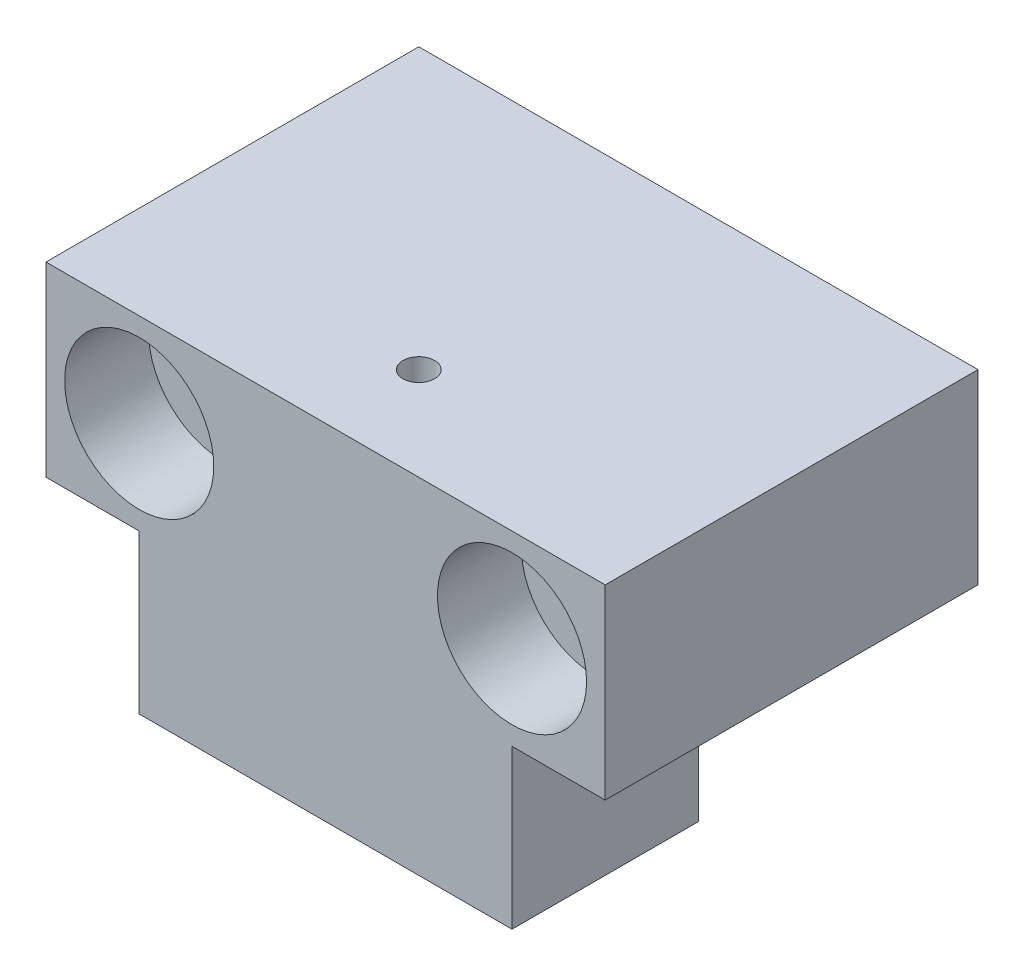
SolidWorks part; units mm, degrees
ref_plane "前视基准面" through (0, 0, 0) normal (0, 0, 1) x (1, 0, 0)
ref_plane "上视基准面" through (0, 0, 0) normal (0, 1, 0) x (1, 0, 0)
ref_plane "右视基准面" through (0, 0, 0) normal (1, 0, 0) x (0, 0, -1)
sketch "草图1" plane through (0, 0, 0) normal (0, 0, 1) x (1, 0, 0)
  line L0 (0, 8.5) -> (5, 8.5)
  line L1 (5, 0) -> (25, 0)
  line L2 (0, 18.5) -> (30, 18.5)
  line L3 (0, 8.5) -> (0, 18.5)
  line L4 (30, 8.5) -> (30, 18.5)
  line L5 (5, 0) -> (5, 8.5)
  line L6 (25, 0) -> (25, 8.5)
  line L7 (25, 8.5) -> (30, 8.5)
  circle A0 centre (5, 13.5) radius 2.25
  circle A1 centre (25, 13.5) radius 2.25
extrude "凸台-拉伸1" add sketch "草图1" along normal blind 20
sketch "草图2" plane through (0, 0, 20) normal (0, 0, 1) x (1, 0, 0)
  circle A0 centre (5, 13.5) radius 4
  circle A1 centre (25, 13.5) radius 4
extrude "切除-拉伸1" cut sketch "草图2" against normal blind 4.5
sketch "草图3" plane through (30, 0, 0) normal (1, 0, 0) x (0, 0, -1)
  line L0 (-10, 8.5) -> (0, 8.5)
  line L1 (-10, 0) -> (-10, 8.5)
extrude "切除-拉伸2" cut sketch "草图3" against normal through all and the other way through all flip side to cut
sketch "草图4" plane through (0, 18.5, 0) normal (0, 1, 0) x (1, 0, 0)
  circle A0 centre (15, -15) radius 0.85
extrude "切除-拉伸3" cut sketch "草图4" against normal through all
